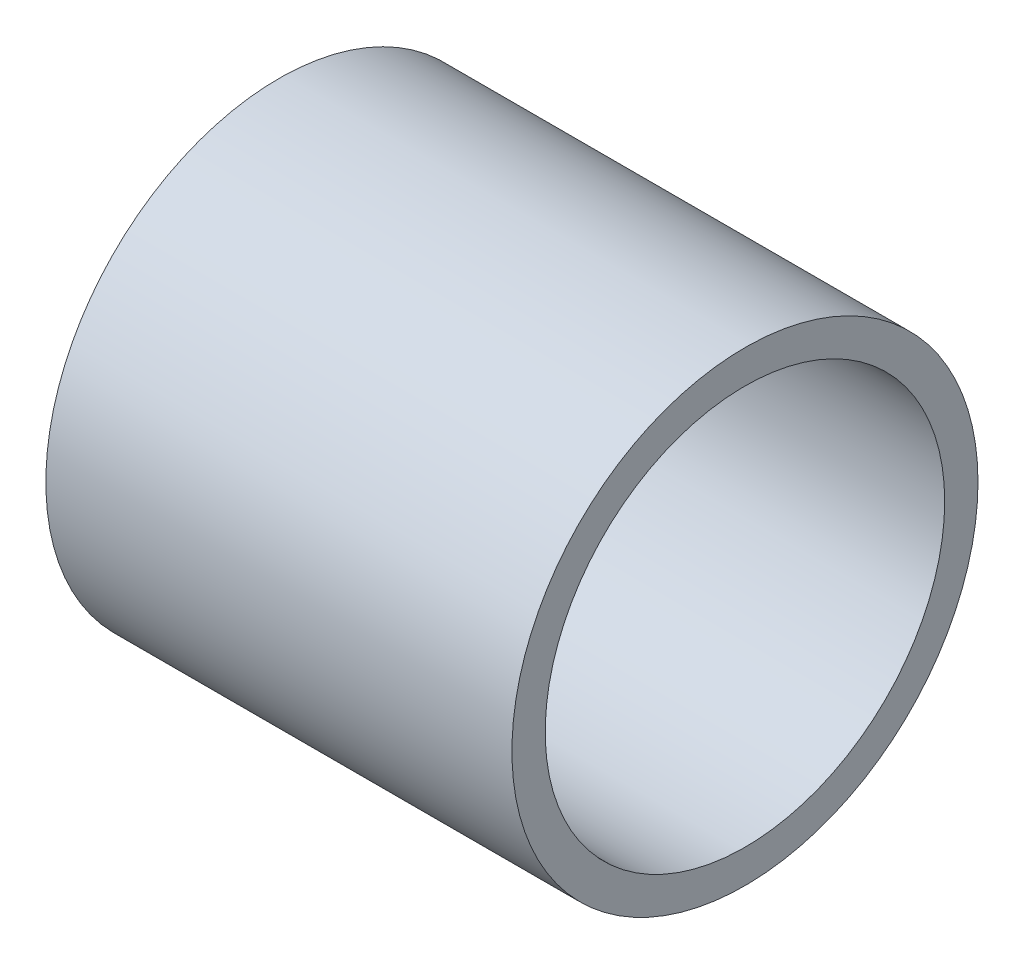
SolidWorks part; units mm, degrees
ref_plane "Front" through (0, 0, 0) normal (0, 0, 1) x (1, 0, 0)
ref_plane "Top" through (0, 0, 0) normal (0, 1, 0) x (1, 0, 0)
ref_plane "Right" through (0, 0, 0) normal (1, 0, 0) x (0, 0, -1)
sketch "Sketch1" plane through (0, 0, 0) normal (0, 0, 1) x (1, 0, 0)
  line L0 (0, 0) -> (88.9, 0)
  line L1 (9.9848, 0) -> (-9.9848, 0) construction
  dimension "D1" = 88.9
other "Structural Member1"
ref_plane "Plane1" through (0, 0, 0) normal (1, 0, 0) x (0, 0, -1)
sketch "Sketch11" plane through (0, 0, 0) normal (1, 0, 0) x (0, 0, -1)
  circle A0 centre (0, 0) radius 38.1
  circle A1 centre (0, 0) radius 44.45
  point P3 (0, 0)
  dimension "D1" = 88.9
  dimension "D2" = 76.2
ref_plane "Plane2" through (0, 0, 44.45) normal (0, 0, 1) x (1, 0, 0)
